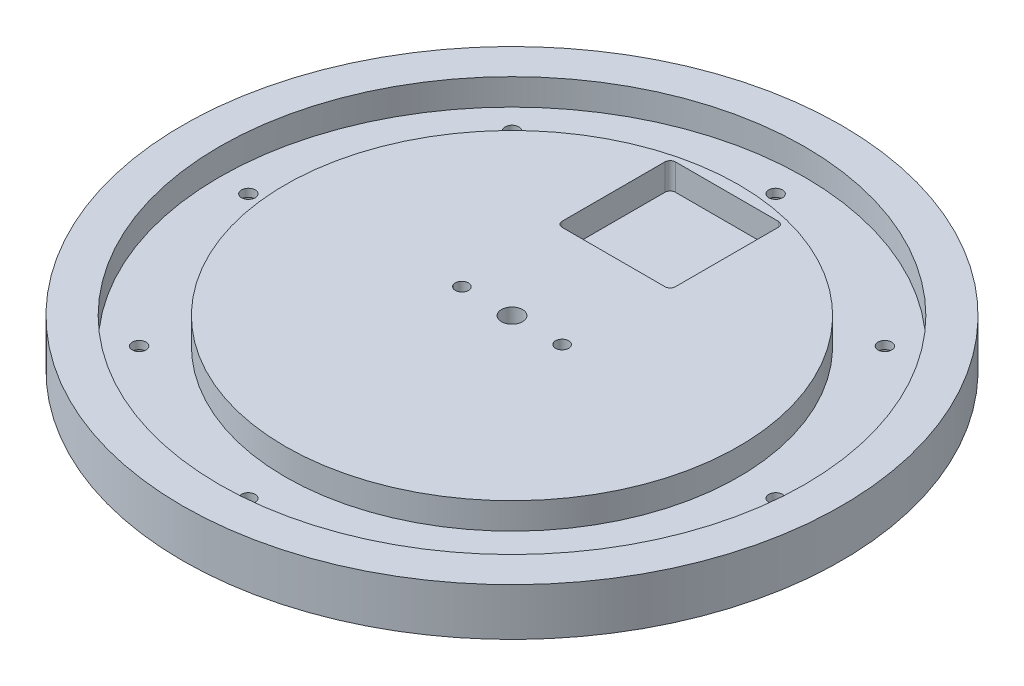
SolidWorks part; units mm, degrees
ref_plane "Front Plane" through (0, 0, 0) normal (0, 0, 1) x (1, 0, 0)
ref_plane "Top Plane" through (0, 0, 0) normal (0, 1, 0) x (1, 0, 0)
ref_plane "Right Plane" through (0, 0, 0) normal (1, 0, 0) x (0, 0, -1)
sketch "Sketch1" plane through (0, 0, 0) normal (0, 1, 0) x (1, 0, 0)
  circle A0 centre (0, 0) radius 110 construction
  circle A1 centre (0, 0) radius 90 construction
  circle A2 centre (0, 0) radius 125
  dimension "D1" = 220
  dimension "D2" = 180
  dimension "D3" = 15
extrude "Boss-Extrude1" add sketch "Sketch1" along normal blind 18
sketch "Sketch2" plane through (0, 18, 0) normal (0, 1, 0) x (1, 0, 0)
  circle A0 centre (0, 0) radius 111
  circle A1 centre (0, 0) radius 86
  dimension "D1" = 222
  dimension "D2" = 172
extrude "Cut-Extrude1" cut sketch "Sketch2" against normal blind 10
sketch "Sketch3" plane through (0, 0, 0) normal (0, -1, 0) x (1, 0, 0)
  line L0 (90, 0) -> (110, 0) construction
  circle A0 centre (0, 0) radius 90 construction
  circle A1 centre (0, 0) radius 110 construction
  circle A2 centre (100, 0) radius 2.6
  circle A3 centre (70.7107, -70.7107) radius 2.6
  circle A4 centre (0, -100) radius 2.6
  circle A5 centre (-70.7107, -70.7107) radius 2.6
  circle A6 centre (-100, 0) radius 2.6
  circle A7 centre (-70.7107, 70.7107) radius 2.6
  circle A8 centre (0, 100) radius 2.6
  circle A9 centre (70.7107, 70.7107) radius 2.6
  point P24 (0, 0)
  dimension "D1" = 220
  dimension "D2" = 180
  dimension "D3" = 5.2
  dimension "D4" = 8
extrude "Cut-Extrude2" cut sketch "Sketch3" against normal blind 10
sketch "Sketch4" plane through (0, 0, 0) normal (0, -1, 0) x (1, 0, 0)
  circle A0 centre (0, 100) radius 5
  circle A1 centre (70.7107, 70.7107) radius 5
  circle A2 centre (100, 0) radius 5
  circle A3 centre (70.7107, -70.7107) radius 5
  circle A4 centre (0, -100) radius 5
  circle A5 centre (-70.7107, -70.7107) radius 5
  circle A6 centre (-100, 0) radius 5
  circle A7 centre (-70.7107, 70.7107) radius 5
  point P20 (0, 0)
  dimension "D1" = 10
  dimension "D2" = 8
extrude "Cut-Extrude3" cut sketch "Sketch4" against normal blind 5
sketch "Sketch5" plane through (0, 18, 0) normal (0, 1, 0) x (1, 0, 0)
  circle A0 centre (0, 0) radius 4
  dimension "D1" = 8
extrude "Cut-Extrude4" cut sketch "Sketch5" against normal through all both and the other way through all
sketch "Sketch6" plane through (0, 0, 0) normal (0, -1, 0) x (1, 0, 0)
  circle A0 centre (0, 0) radius 10
  dimension "D1" = 20
extrude "Cut-Extrude5" cut sketch "Sketch6" against normal blind 8
sketch "Sketch7" plane through (0, 18, 0) normal (0, 1, 0) x (1, 0, 0)
  line L0 (-19, 0) -> (19, 0) construction
  circle A0 centre (19, 0) radius 2.5
  circle A1 centre (-19, 0) radius 2.5
  point P5 (0, 0)
  dimension "D1" = 5
  dimension "D2" = 38
extrude "Cut-Extrude6" cut sketch "Sketch7" against normal through all
sketch "Sketch8" plane through (0, 18, 0) normal (0, 1, 0) x (1, 0, 0)
  line L1 (-21.5, 81.5) -> (21.5, 81.5)
  line L2 (-21.5, 81.5) -> (-21.5, 38.5)
  line L3 (-21.5, 38.5) -> (21.5, 38.5)
  line L4 (21.5, 81.5) -> (21.5, 38.5)
extrude "Cut-Extrude7" cut sketch "Sketch8" against normal blind 10
fillet "Fillet1" radius 2 4 edges at (21.5, 13, -38.5) (-21.5, 13, -38.5) (21.5, 13, -81.5) (-21.5, 13, -81.5)
